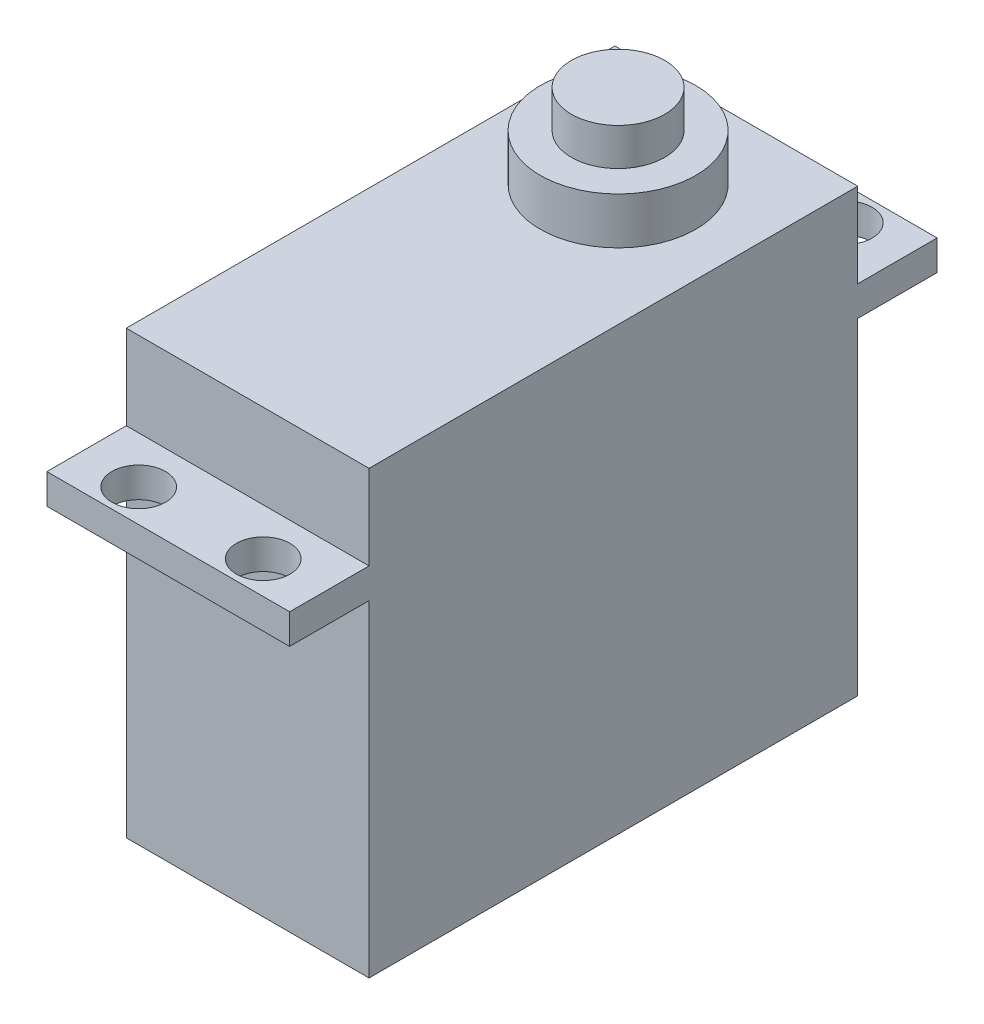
SolidWorks part; units mm, degrees
ref_plane "Front Plane" through (0, 0, 0) normal (0, 0, 1) x (1, 0, 0)
ref_plane "Top Plane" through (0, 0, 0) normal (0, 1, 0) x (1, 0, 0)
ref_plane "Right Plane" through (0, 0, 0) normal (1, 0, 0) x (0, 0, -1)
sketch "Sketch1" plane through (0, 0, 0) normal (0, 1, 0) x (1, 0, 0)
  line L0 (-9.906, 0) -> (9.906, 0) construction
  line L1 (-9.906, 19.939) -> (9.906, 19.939)
  line L2 (-9.906, 19.939) -> (-9.906, -19.939)
  line L3 (-9.906, -19.939) -> (9.906, -19.939)
  line L4 (9.906, 19.939) -> (9.906, -19.939)
  point P4 (-9.906, 0)
  point P5 (9.906, 0)
  dimension "D1" = 19.812
  dimension "D2" = 39.878
extrude "Extrude1" add sketch "Sketch1" along normal blind 36.0172
sketch "Sketch3" plane through (0, 0, 19.939) normal (0, 0, 1) x (1, 0, 0)
  line L1 (-9.906, 29.12) -> (9.906, 29.12)
  line L2 (-9.906, 29.12) -> (-9.906, 26.67)
  line L3 (-9.906, 26.67) -> (9.906, 26.67)
  line L4 (9.906, 29.12) -> (9.906, 26.67)
  line L5 (9.906, 36.0172) -> (9.906, 0) construction
  line L6 (-9.906, 36.0172) -> (-9.906, 0) construction
  line L7 (-9.906, 0) -> (9.906, 0) construction
  dimension "D1" = 2.45
  dimension "D2" = 26.67
extrude "Extrude3" add sketch "Sketch3" along normal blind 6.477
mirror "Mirror1" about plane through (0, 0, 0) normal (0, 0, 1) of "Extrude3"
sketch "Sketch4" plane through (0, 36.0172, 0) normal (0, 1, 0) x (1, 0, 0)
  line L0 (9.906, 19.939) -> (-9.906, 19.939) construction
  circle A0 centre (0, 10.287) radius 6.35
  dimension "D1" = 12.7
  dimension "D2" = 9.652
sketch "Sketch5" plane through (0, 29.12, 0) normal (0, 1, 0) x (1, 0, 0)
  line L0 (0, -19.939) -> (0, -26.416) construction
  line L1 (9.906, -19.939) -> (-9.906, -19.939) construction
  line L2 (9.906, -26.416) -> (-9.906, -26.416) construction
  circle A0 centre (5.08, -23.749) radius 2.1844
  point P6 (5.08, -23.749)
  dimension "D3" = 4.3688
  dimension "D1" = 3.81
  dimension "D2" = 5.08
extrude "Cut-Extrude1" cut sketch "Sketch5" against normal through all
mirror "Mirror2" about plane through (0, 0, 0) normal (0, 0, 1) of "Cut-Extrude1"
mirror "Mirror3" about plane through (0, 0, 0) normal (1, 0, 0) of "Mirror2", "Cut-Extrude1"
extrude "Extrude4" add sketch "Sketch4" along normal blind 3.81
sketch "Sketch6" plane through (0, 39.8272, 0) normal (0, 1, 0) x (1, 0, 0)
  circle A0 centre (0, 10.287) radius 3.81
  point P0 (0, 10.287)
  dimension "D1" = 7.62
extrude "Extrude5" add sketch "Sketch6" along normal blind 3.048
